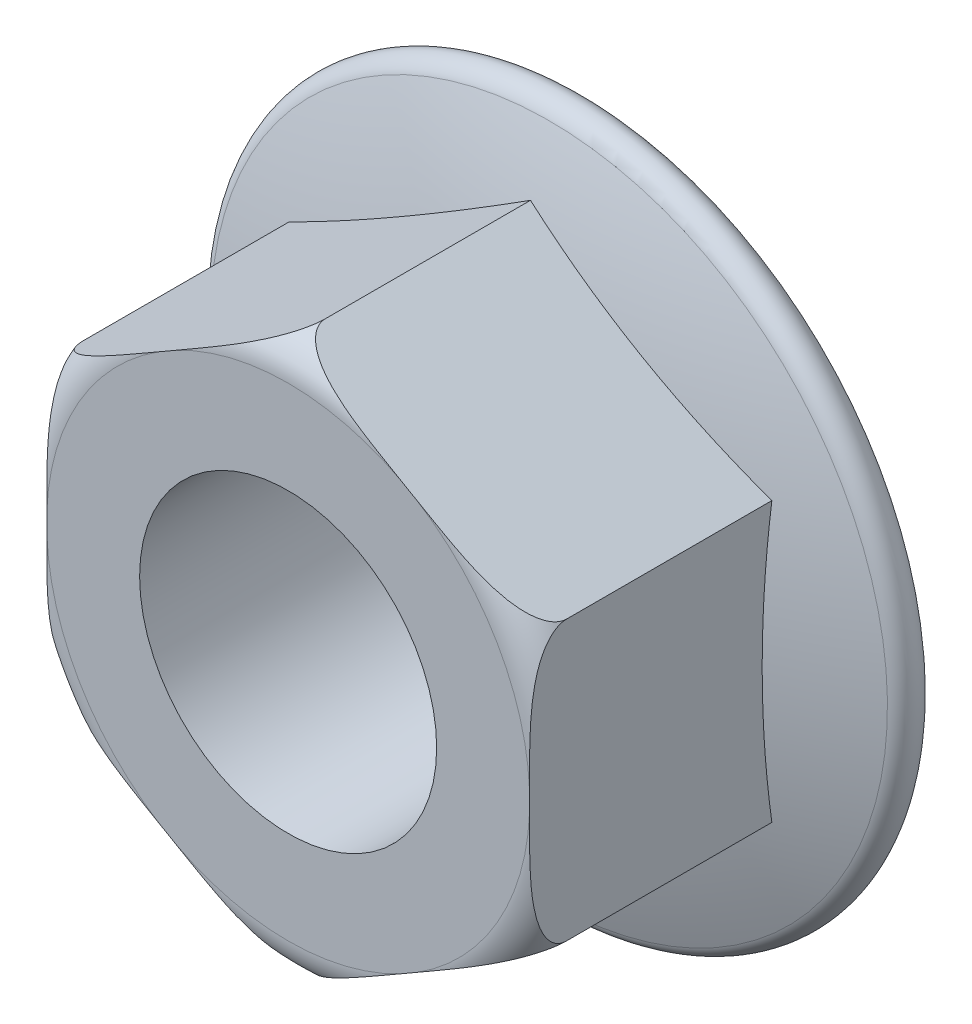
SolidWorks part; units mm, degrees
ref_plane "Plane1" through (0, 0, 0) normal (0, 0, 1) x (1, 0, 0)
ref_plane "Plane2" through (0, 0, 0) normal (0, 1, 0) x (-1, 0, 0)
ref_plane "Plane3" through (0, 0, 0) normal (1, 0, 0) x (0, 0, -1)
sketch "Head Sketch" plane through (0, 0, 0) normal (0, 0, 1) x (1, 0, 0)
  line L0 (0, 7.5056) -> (6.5, 3.7528)
  line L1 (6.5, 3.7528) -> (6.5, -3.7528)
  line L2 (6.5, -3.7528) -> (0, -7.5056)
  line L3 (0, -7.5056) -> (-6.5, -3.7528)
  line L4 (-6.5, -3.7528) -> (-6.5, 3.7528)
  line L5 (-6.5, 3.7528) -> (0, 7.5056)
  line L6 (6.5, 3.7528) -> (-6.5, -3.7528) construction
  line L7 (0, 7.5056) -> (0, -7.5056) construction
  line L8 (-6.5, 3.7528) -> (6.5, -3.7528) construction
  point P0 (0, 0)
  dimension "D1" = 60
  dimension "D2" = 60
  dimension "Flats" = 13
extrude "Head" add sketch "Head Sketch" along normal blind 8
sketch "Flange Sketch" plane through (0, 0, 0) normal (0, 1, 0) x (-1, 0, 0)
  line L0 (0, 1.8434) -> (0, 2.5) construction
  line L1 (-8.95, 0) -> (0, 0)
  line L2 (0, 50) -> (0, -50) construction
  line L4 (0, 0) -> (0, 2.5)
  line L5 (0, 0) -> (-6.5, 0) construction
  arc A0 (0, 2.5) -> (-9.113, 0.9727) centre (0, -25.4508) ccw
  arc A1 (-8.95, 0) -> (-9.113, 0.9727) centre (-8.95, 0.5) cw
  dimension "D1" = 0.5
  dimension "D3" = 17.9
  dimension "Flange Height" = 2.5
revolve "Flange" add sketch "Flange Sketch" angle 360 about L0
sketch "Sketch5" plane through (0, 0, 0) normal (1, 0, 0) x (0, 0, -1)
  line L0 (-8, -6.5056) -> (-8, -7.5056)
  line L1 (-8, -7.5056) -> (-7, -7.5056)
  line L2 (-8, -7.5056) -> (-1.4734, -7.5056) construction
  line L3 (-8, -7.5056) -> (-8, -3.7528) construction
  line L5 (-15.0856, 0) -> (-8.1394, 0) construction
  line L6 (50, 0) -> (-50, 0) construction
  arc A0 (-8, -6.5056) -> (-7, -7.5056) centre (-7, -6.5056) ccw
  dimension "D1" = 1
revolve "Head Trim" cut sketch "Sketch5" angle 360 about L5
sketch "Hole Sketch" plane through (0, 0, 8) normal (0, 0, 1) x (1, 0, 0)
  line L0 (50, 0) -> (-50, 0) construction
  line L1 (0, -50) -> (0, 50) construction
  circle A0 centre (0, 0) radius 4
  dimension "Hole Dia" = 8
extrude "Through Hole" cut sketch "Hole Sketch" against normal through all
